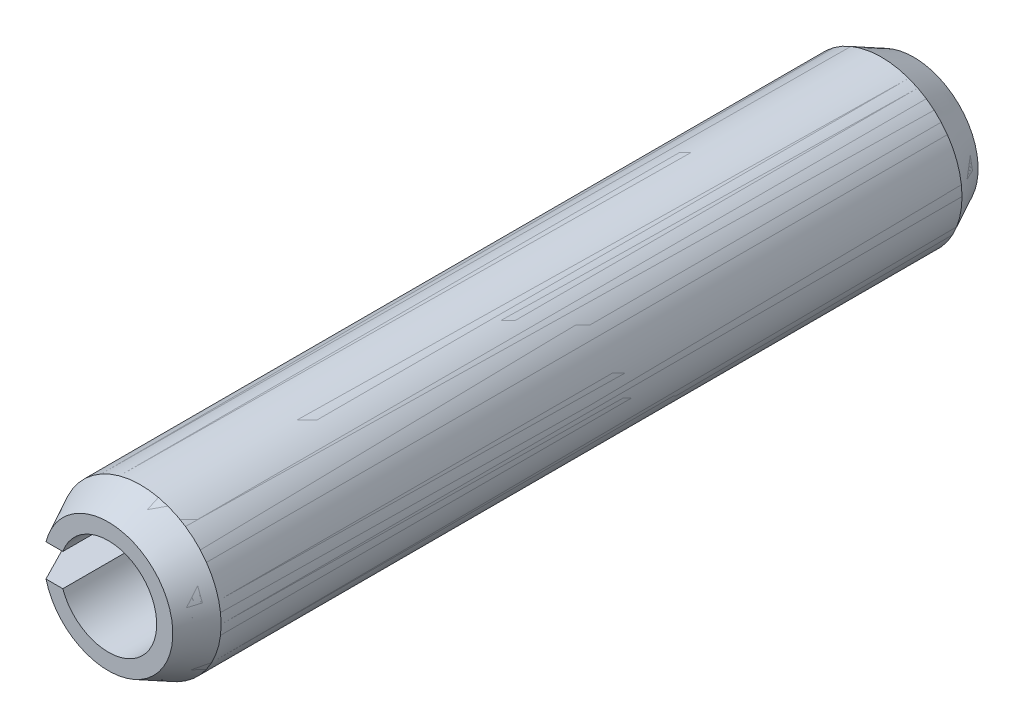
SolidWorks part; units mm, degrees
ref_plane "Face" through (0, 0, 0) normal (0, 0, 1) x (1, 0, 0)
ref_plane "Dessus" through (0, 0, 0) normal (0, 1, 0) x (1, 0, 0)
ref_plane "Droite" through (0, 0, 0) normal (1, 0, 0) x (0, 0, -1)
imported_body "Goupille élastique, épaisse, de 10 x 50 - NF E 27-489"
sketch "Esquisse1" plane through (0, 0, 0) normal (0, 0, 1) x (1, 0, 0)
  line L0 (-4.899, 1) -> (-3.873, 1) construction
  line L1 (-3.873, 1) -> (-2.8284, 1)
  line L2 (-3.873, -1) -> (-4.899, -1) construction
  line L3 (-2.8284, -1) -> (-3.873, -1)
  arc A1 (-3.873, -1) -> (-3.873, 1) centre (0, 0) ccw construction
  arc A2 (-2.9047, -0.75) -> (-2.9047, 0.75) centre (0, 0) ccw
  arc A3 (-2.8284, -1) -> (-2.8284, 1) centre (0, 0) ccw
  arc A4 (-3.873, -1) -> (-3.873, 1) centre (0, 0) ccw
  dimension "D1" = 1
extrude "Boss.-Extru.2" add sketch "Esquisse1" along normal blind 50
